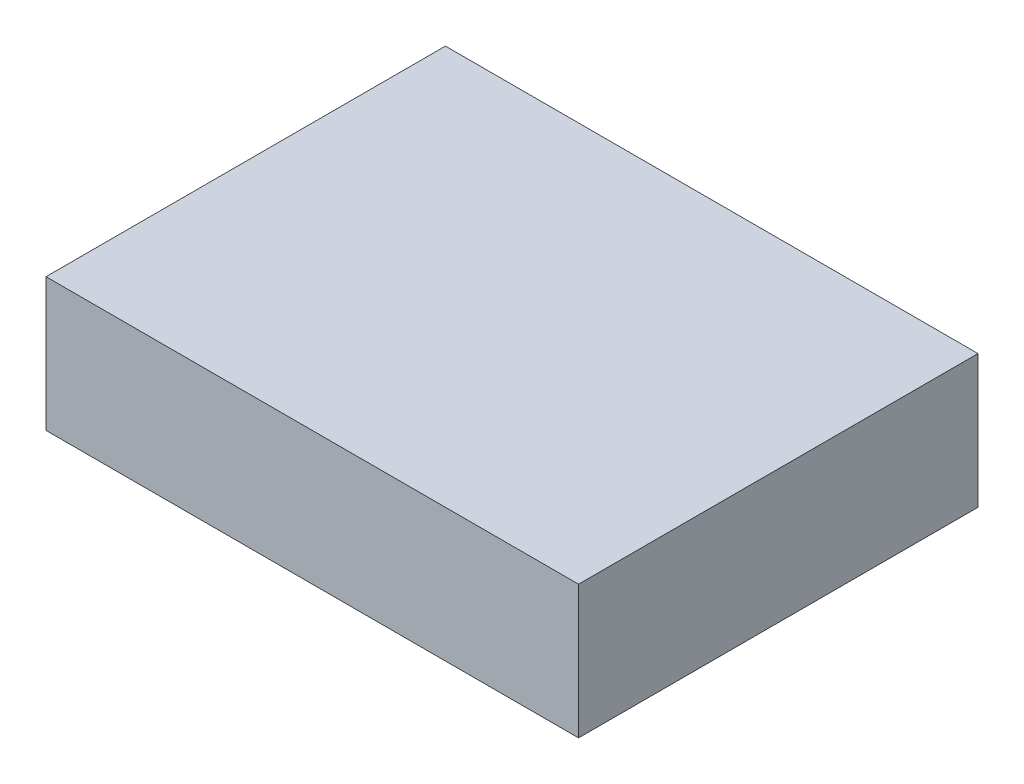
SolidWorks part; units mm, degrees
ref_plane "Vorderseite" through (0, 0, 0) normal (0, 0, 1) x (1, 0, 0)
ref_plane "oben" through (0, 0, 0) normal (0, 1, 0) x (-1, 0, 0)
ref_plane "rechts" through (0, 0, 0) normal (1, 0, 0) x (0, 0, -1)
sketch "Skizze1" plane through (0, 0, 0) normal (0, 0, 1) x (1, 0, 0)
  line L0 (-20, 0) -> (20, 0) construction
  line L1 (-20, -5) -> (20, -5)
  line L2 (-20, -5) -> (-20, 5)
  line L3 (-20, 5) -> (20, 5)
  line L4 (20, -5) -> (20, 5)
  dimension "D1" = 10
  dimension "D2" = 40
extrude "Linear austragen1" add sketch "Skizze1" along normal mid plane 30
